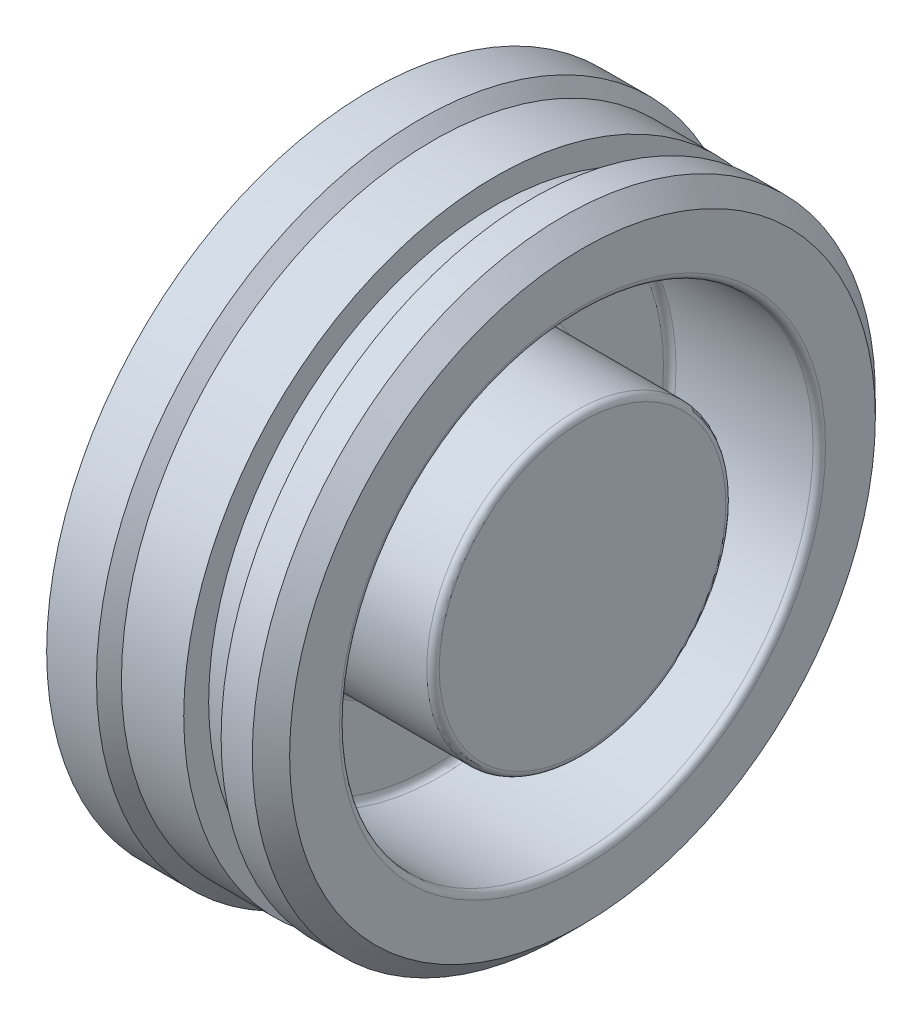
SolidWorks part; units mm, degrees
ref_plane "Face" through (0, 0, 0) normal (0, 0, 1) x (1, 0, 0)
ref_plane "Dessus" through (0, 0, 0) normal (0, 1, 0) x (1, 0, 0)
ref_plane "Droite" through (0, 0, 0) normal (1, 0, 0) x (0, 0, -1)
sketch "Esquisse1" plane through (0, 0, 0) normal (0, 0, 1) x (1, 0, 0)
  line L0 (-21, 12.5) -> (-57.5, 12.5) construction
  line L1 (-57.5, 12.5) -> (-58, 13) construction
  line L2 (-58, 13) -> (-60.2, 13) construction
  line L3 (-51.5, 12.5) -> (-53.5, 12.5)
  line L4 (-57.5, 12.5) -> (-58, 13)
  line L5 (-58, 13) -> (-60, 13)
  line L6 (-60, 13) -> (-60, 0)
  line L7 (-51.5, 12.5) -> (-51.5, 0)
  line L8 (-72.748, 0) -> (14.5054, 0) construction
  line L9 (-60, 25) -> (0, 25) construction
  line L10 (-60, 0) -> (-51.5, 0)
  line L11 (-55, 12.5) -> (-55, 11.5)
  line L12 (-55, 11.5) -> (-53.5, 11.5)
  line L13 (-53.5, 11.5) -> (-53.5, 12.5)
  line L14 (-55, 12.5) -> (-57.5, 12.5)
  dimension "D1" = 25
  dimension "D2" = 8.5
  dimension "D3" = 2
  dimension "D4" = 1.5
  dimension "D5" = 2
  dimension "D6" = 1
revolve "Révolution1" add sketch "Esquisse1" angle 360 about L8
chamfer "Chanfrein1" distance 0.75 angle 45
sketch "Esquisse2" plane through (-51.5, 0, 0) normal (1, 0, 0) x (0, 0, -1)
  circle A0 centre (0, 0) radius 6
  circle A1 centre (0, 0) radius 9.5
  dimension "D1" = 12
  dimension "D2" = 19
extrude "Enlèv. mat.-Extru.1" cut sketch "Esquisse2" against normal blind 6
fillet "Congé1" radius 0.25
